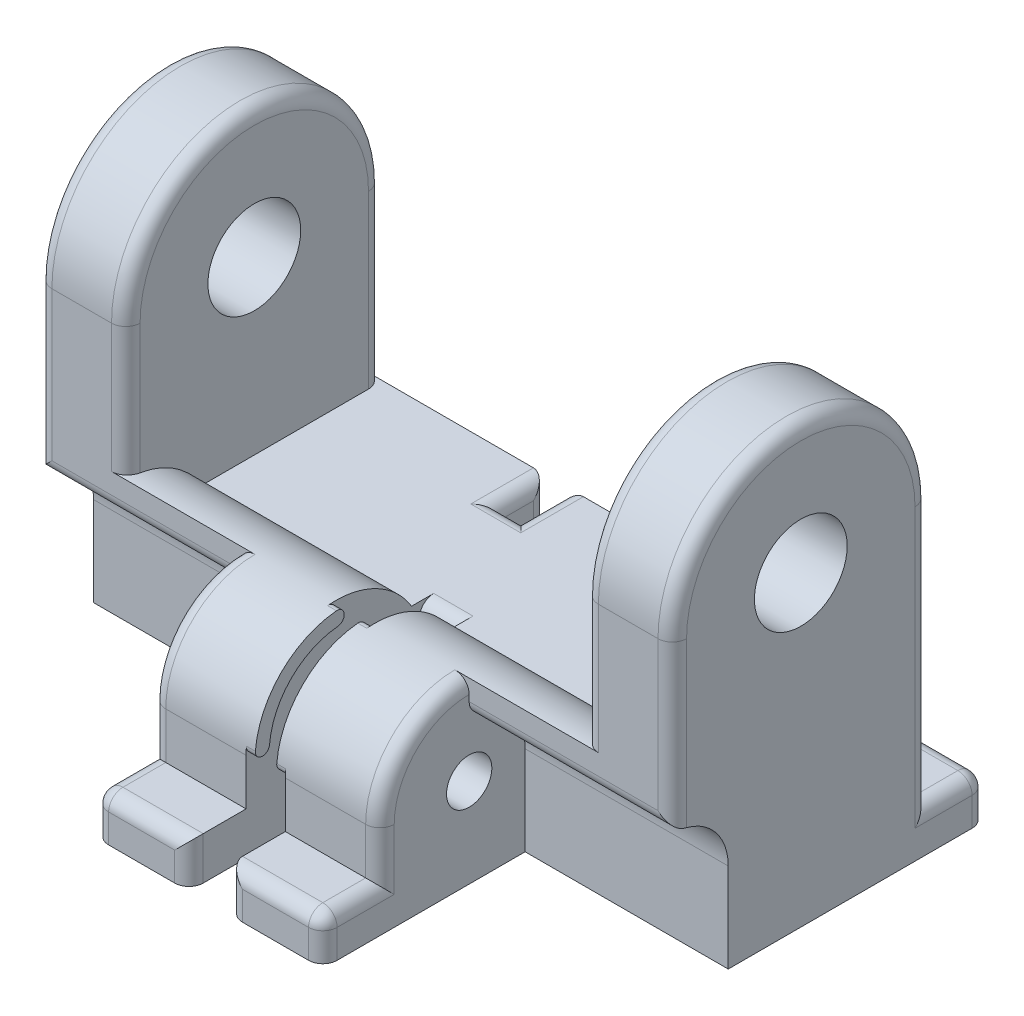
SolidWorks part; units mm, degrees
ref_plane "Front Plane" through (0, 0, 0) normal (0, 0, 1) x (1, 0, 0)
ref_plane "Top Plane" through (0, 0, 0) normal (0, 1, 0) x (1, 0, 0)
ref_plane "Right Plane" through (0, 0, 0) normal (1, 0, 0) x (0, 0, -1)
sketch "Sketch1" plane through (0, 0, 0) normal (1, 0, 0) x (0, 0, -1)
  line L0 (0, 0) -> (39.0226, 0) construction
  line L1 (0, 0) -> (0, 6.25) construction
  line L2 (-6.25, 6.25) -> (-6.25, 0) construction
  line L3 (-10.25, 0) -> (22, 0)
  line L4 (-10.25, 0) -> (-10.25, 3)
  line L5 (-10.25, 3) -> (-6.25, 3)
  line L6 (-6.25, 3) -> (-6.25, 6.25)
  line L7 (-6.25, 0) -> (0, 0) construction
  line L8 (0, 12.5) -> (18.6083, 12.5) construction
  line L9 (52.3127, 6) -> (-34.6817, 6) construction
  line L10 (0, 21.5) -> (0, 12.5)
  line L12 (18, 21.5) -> (18, 3)
  line L13 (18, 3) -> (22, 3)
  line L14 (22, 3) -> (22, 0)
  line L15 (-4.75, 6.25) -> (-4.75, 26.7415) construction
  circle A0 centre (0, 6.25) radius 1.5875
  circle A1 centre (0, 6.25) radius 4.75 construction
  circle A2 centre (0, 6.25) radius 6.25 construction
  circle A3 centre (9, 21.5) radius 9 construction
  circle A4 centre (9, 21.5) radius 3.25
  arc A5 (18, 21.5) -> (0, 21.5) centre (9, 21.5) ccw
  arc A6 (-6.25, 6.25) -> (0, 12.5) centre (0, 6.25) cw
  dimension "D1" = 3.175
  dimension "D2" = 9.5
  dimension "D3" = 12.5
  dimension "D6" = 6.5
  dimension "D7" = 18
  dimension "D8" = 6
  dimension "D9" = 22.75
  dimension "D4" = 3
  dimension "D5" = 4
extrude "Main Body" add sketch "Sketch1" along normal mid plane 44.45
sketch "Sketch2" plane through (0, 0, 0) normal (1, 0, 0) x (0, 0, -1)
  line L0 (-6.25, 6.25) -> (-6.25, 3) construction
  line L1 (-6.25, 3) -> (-10.25, 3) construction
  line L2 (-10.25, 3) -> (-10.25, 0) construction
  line L3 (-10.25, 0) -> (22, 0) construction
  line L4 (-6.25, 6.25) -> (-6.25, 3)
  line L5 (-6.25, 3) -> (-10.25, 3)
  line L6 (-10.25, 3) -> (-10.25, 0)
  line L7 (-10.25, 0) -> (6.25, 0)
  line L8 (6.25, 6.25) -> (6.25, 0)
  arc A1 (0, 12.5) -> (-6.25, 6.25) centre (0, 6.25) ccw construction
  arc A2 (0, 12.5) -> (6.25, 6.25) centre (0, 6.25) cw
  arc A3 (0, 12.5) -> (-6.25, 6.25) centre (0, 6.25) ccw
extrude "Pulley Clearance" cut sketch "Sketch2" against normal mid plane 2.75
sketch "Sketch3" plane through (0, 0, 0) normal (1, 0, 0) x (0, 0, -1)
  line L1 (0, 21.5) -> (0, 12.5) construction
  line L2 (0, 21.5) -> (0, 12.5)
  line L5 (18, 3) -> (18, 21.5) construction
  line L6 (18, 9.5) -> (18, 21.5)
  line L7 (5.3385, 9.5) -> (18, 9.5)
  circle A0 centre (0, 6.25) radius 4.75 construction
  arc A1 (18, 21.5) -> (0, 21.5) centre (9, 21.5) ccw construction
  arc A2 (18, 21.5) -> (0, 21.5) centre (9, 21.5) ccw
  arc A3 (0, 12.5) -> (5.3385, 9.5) centre (0, 6.25) cw
  dimension "D1" = 9.5
  dimension "D2" = 3
extrude "Finger Clearance" cut sketch "Sketch3" against normal mid plane 31.75
sketch "Sketch7" plane through (22.225, 0, 0) normal (1, 0, 0) x (0, 0, -1)
  line L0 (-6.25, 6.25) -> (-6.25, 3) construction
  line L1 (-6.25, 3) -> (-10.25, 3) construction
  line L2 (-10.25, 3) -> (-10.25, 0) construction
  line L3 (-6.25, 6.25) -> (-6.25, 3)
  line L4 (-6.25, 3) -> (-10.25, 3)
  line L5 (-10.25, 3) -> (-10.25, 0)
  line L6 (0, 12.5) -> (0, 0)
  line L7 (0, 0) -> (-10.25, 0)
  line L8 (-6.25, 6.25) -> (6.25, 6.25) construction
  arc A0 (0, 12.5) -> (-6.25, 6.25) centre (0, 6.25) ccw construction
  arc A1 (0, 12.5) -> (-6.25, 6.25) centre (0, 6.25) ccw
extrude "Side Clearance 1" cut sketch "Sketch7" against normal blind 14.225
sketch "Sketch8" plane through (-22.225, 0, 0) normal (-1, 0, 0) x (0, 0, 1)
  line L0 (6.25, 6.25) -> (6.25, 3) construction
  line L1 (6.25, 3) -> (10.25, 3) construction
  line L2 (10.25, 3) -> (10.25, 0) construction
  line L3 (6.25, 6.25) -> (6.25, 3)
  line L4 (6.25, 3) -> (10.25, 3)
  line L5 (10.25, 3) -> (10.25, 0)
  line L6 (0, 12.5) -> (0, 0)
  line L7 (0, 0) -> (10.25, 0)
  arc A0 (6.25, 6.25) -> (0, 12.5) centre (0, 6.25) ccw construction
  arc A1 (6.25, 6.25) -> (0, 12.5) centre (0, 6.25) ccw
extrude "Side Clearance 2" cut sketch "Sketch8" against normal blind 14.225
sketch "Sketch9" plane through (8, 0, 0) normal (1, 0, 0) x (0, 0, -1)
  line L0 (-3.9188, 6.25) -> (-6.25, 6.25) construction
  line L1 (0, 7.8375) -> (0, 10.1688) construction
  line L2 (3.9188, 6.25) -> (3.9188, 0)
  line L3 (3.9188, 0) -> (-3.9188, 0)
  line L4 (0, 0) -> (-10.25, 0) construction
  line L5 (-3.9188, 0) -> (-3.9188, 6.25)
  arc A0 (3.9188, 6.25) -> (-3.9188, 6.25) centre (0, 6.25) ccw
extrude "Side Pulley Clearance 1" cut sketch "Sketch9" along normal up to surface (14.225 mm away)
sketch "Sketch10" plane through (-8, 0, 0) normal (-1, 0, 0) x (0, 0, 1)
  line L0 (-3.9188, 6.25) -> (-3.9188, 0)
  line L1 (-3.9188, 0) -> (3.9188, 0)
  line L2 (0, 0) -> (10.25, 0) construction
  line L3 (3.9188, 0) -> (3.9188, 6.25)
  arc A0 (3.9188, 6.25) -> (-3.9188, 6.25) centre (0, 6.25) ccw
  arc A1 (0, 10.1688) -> (-3.9188, 6.25) centre (0, 6.25) ccw construction
extrude "Side Pulley Clearance 2" cut sketch "Sketch10" along normal up to surface (14.225 mm away)
sketch "Sketch11" plane through (0, 0, 0) normal (1, 0, 0) x (0, 0, -1)
  line L0 (5.3385, 9.5) -> (18, 9.5) construction
  line L1 (18, 9.5) -> (18, 21.5) construction
  line L2 (0, 21.5) -> (0, 12.5) construction
  line L3 (5.3385, 9.5) -> (18, 9.5)
  line L4 (18, 9.5) -> (18, 21.5)
  line L5 (0, 21.5) -> (0, 12.5)
  arc A0 (5.3385, 9.5) -> (0, 12.5) centre (0, 6.25) ccw construction
  arc A1 (18, 21.5) -> (0, 21.5) centre (9, 21.5) ccw construction
  arc A2 (5.3385, 9.5) -> (0, 12.5) centre (0, 6.25) ccw
  arc A3 (18, 21.5) -> (0, 21.5) centre (9, 21.5) ccw
extrude "Finger Print Clearance" cut sketch "Sketch11" against normal mid plane 32.1
sketch "Sketch12" plane through (0, 0, 0) normal (1, 0, 0) x (0, 0, -1)
  line L0 (-6.25, 6.25) -> (-5.25, 6.25)
  line L1 (0, 12.5) -> (0, 11.5)
  arc A0 (0, 12.5) -> (-6.25, 6.25) centre (0, 6.25) ccw
  arc A1 (5.3385, 9.5) -> (-6.25, 6.25) centre (0, 6.25) ccw construction
  arc A2 (0, 11.5) -> (-5.25, 6.25) centre (0, 6.25) ccw
  dimension "D1" = 1
extrude "Pully Cover" add sketch "Sketch12" along normal up to surface and the other way up to surface
sketch "Sketch13" plane through (0, 0, 0) normal (0, -1, 0) x (1, 0, 0)
  line L0 (0, 0) -> (0, -6.25) construction
  line L1 (-1.375, -6.25) -> (1.375, -6.25) construction
  line L3 (0.75, 0) -> (-0.75, 0)
  line L4 (0.75, 0) -> (0.75, 10.25)
  line L5 (0.75, 10.25) -> (-0.75, 10.25)
  line L6 (-0.75, 0) -> (-0.75, 10.25)
  dimension "D1" = 1.5
extrude "Pully Cover Cutaway" cut sketch "Sketch13" against normal through all
fillet "Pulley Cover Fillet" radius 0.5 6 edges at (1.0625, 11.5, 0) (1.0625, 12.5, 0) (-1.0625, 11.5, 0) (1.0625, 6.25, 5.25) (1.0625, 6.25, 6.25) (-1.0625, 6.25, 5.25)
sketch "Sketch15" plane through (0, 0, -18) normal (0, 0, -1) x (-1, 0, 0)
  line L0 (0, 0) -> (0, 9.5) construction
  line L1 (16.05, 9.5) -> (-16.05, 9.5) construction
  line L3 (4.5, 9.5) -> (3, 9.5)
  line L4 (4.5, 9.5) -> (4.5, 6)
  line L5 (4.5, 6) -> (3, 6)
  line L6 (3, 9.5) -> (3, 6)
  dimension "D1" = 6
  dimension "D2" = 3
  dimension "D3" = 1.5
revolve "Torsion Spring Notches" cut sketch "Sketch15" angle 360
fillet "Contouring" radius 1 38 edges at (-22.225, 12.25, -18) (8, 1.5, 10.25) (8, 3, 8.25) (8, 4.625, 6.25) (-22.225, 3, -20) (-22.225, 1.5, -22) (-8, 10.6694, 4.4194) (-8, 4.625, 6.25) (-8, 3, 8.25) (-8, 1.5, 10.25) (15.1125, 10.1688, 0) (0, 3, -22) (-15.1125, 10.1688, 0) (22.225, 1.5, -22) (-16.05, 17, 0) (-16.05, 30.5, -9) (-16.05, 15.5, -18) (16.05, 15.5, -18) (16.05, 30.5, -9) (16.05, 17, 0) (22.225, 3, -20) (22.225, 12.25, -18) (22.225, 30.5, -9) (22.225, 15.8344, 0) (-3, 9.5, -16.25) (-3.75, 9.5, -14.5) (-4.5, 9.5, -16.25) (-4.5, 7.75, -18) (-3.75, 6, -18) (-3, 7.75, -18) (-4.6875, 3, 10.25) (-1.375, 1.5, 10.25) (1.375, 1.5, 10.25) (0, 9.5, -5.3385) (-22.225, 15.8344, 0) (4.6875, 3, 10.25) (-22.225, 30.5, -9) (8, 10.6694, 4.4194)
ref_point "Ref Center"
equation "\"D1@Sketch1\"=\"pin diameter@values@params.sldprt\""
equation "\"D2@Sketch1\"=\"pulley diameter@values@params.sldprt\""
equation "\"D3@Sketch1\"=\"pulley diameter@values@params.sldprt\"+\"width keep@values@params.sldprt\""
equation "\"D7@Sketch1\" = \"finger height@values@params.sldprt\""
equation "\"D4@Sketch1\"=\"width keep@values@params.sldprt\""
equation "\"D5@Sketch1\"=\"width tab@values@params.sldprt\""
equation "\"D8@Sketch1\"=2*\"width keep@values@params.sldprt\""
equation "\"D1@Pulley Clearance\"=\"pulley thickness@values@params.sldprt\"+0.35"
equation "\"D1@Sketch3\"=\"pulley diameter@values@params.sldprt\""
equation "\"D1@Finger Clearance\"=\"finger depth@values@params.sldprt\""
equation "\"D2@Sketch3\"=\"width keep@values@params.sldprt\""
equation "\"D9@Sketch1\" = \"LB pivot@values@params.sldprt\""
equation "\"D1@Finger Print Clearance\"=\"finger depth@values@params.sldprt\"+\"print free@values@params.sldprt\""
equation "\"D1@Sketch15\"=2*\"width keep@values@params.sldprt\""
equation "\"D2@Sketch15\"=\"width keep@values@params.sldprt\""
equation "\"D1@Main Body\"=\"finger base depth@values@params.sldprt\""
equation "\"D1@Side Clearance 2\"=(\"finger base depth@values@params.sldprt\"-16)/2"
equation "\"D1@Side Clearance 1\"=(\"finger base depth@values@params.sldprt\"-16)/2"
